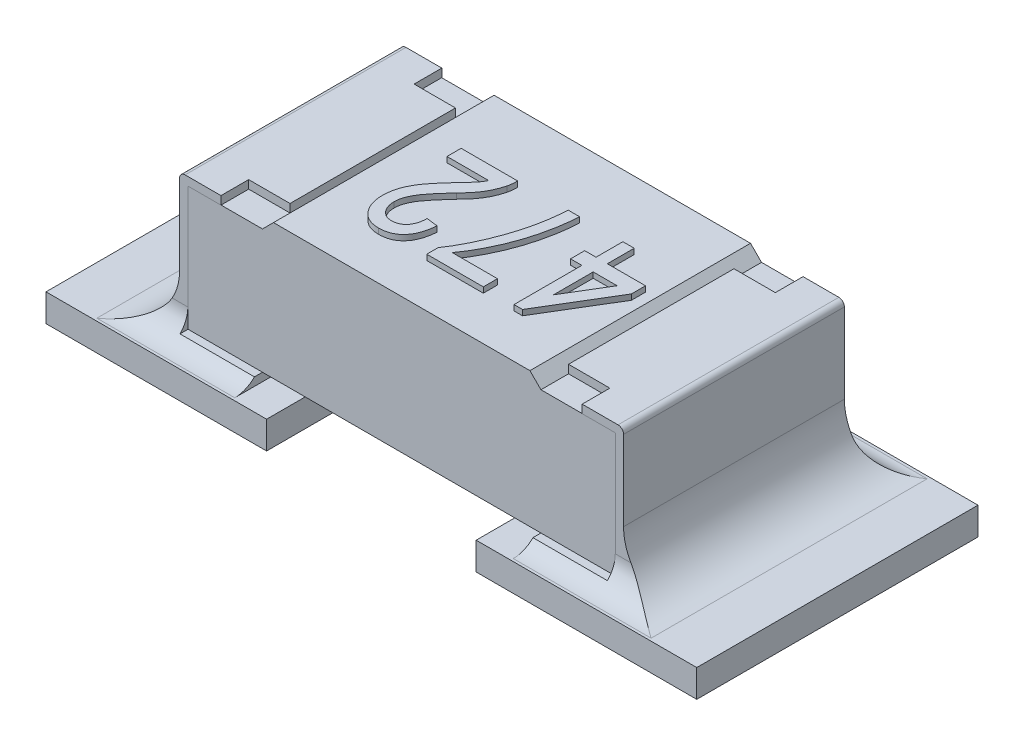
SolidWorks part; units mm, degrees
ref_plane "Plan de face" through (0, 0, 0) normal (0, 0, 1) x (1, 0, 0)
ref_plane "Plan de dessus" through (0, 0, 0) normal (0, 1, 0) x (1, 0, 0)
ref_plane "Plan de droite" through (0, 0, 0) normal (1, 0, 0) x (0, 0, -1)
sketch "Esquisse1" plane through (0, 0, 0) normal (1, 0, 0) x (0, 0, -1)
  line L1 (-0.4, 0.58) -> (0.4, 0.58)
  line L2 (-0.4, 0.58) -> (-0.4, 0.13)
  line L3 (-0.4, 0.13) -> (0.4, 0.13)
  line L4 (0.4, 0.58) -> (0.4, 0.13)
  dimension "D1" = 0.13
  dimension "D2" = 0.4
  dimension "D3" = 0.8
  dimension "D4" = 0.45
extrude "Extrusion1" add sketch "Esquisse1" along normal mid plane 1.55
sketch "Esquisse2" plane through (0, 0, 0) normal (0, 0, 1) x (1, 0, 0)
  line L4 (-0.505, 0.61) -> (-0.505, 0.58)
  line L5 (0.775, 0.58) -> (-0.775, 0.58) construction
  line L6 (-0.505, 0.13) -> (-0.505, 0.1)
  line L7 (0.775, 0.13) -> (-0.775, 0.13) construction
  line L8 (-0.805, 0.61) -> (-0.805, 0.1)
  line L9 (-0.805, 0.1) -> (0.805, 0.1)
  line L10 (0.805, 0.1) -> (0.805, 0.61)
  line L11 (0.805, 0.61) -> (-0.805, 0.61)
  line L12 (-0.805, 0.59) -> (-0.805, 0.1)
  line L13 (0.505, 0.61) -> (0.785, 0.61)
  line L14 (0.805, 0.1) -> (0.805, 0.59)
  line L15 (0.505, 0.1) -> (0.805, 0.1)
  line L16 (0.505, 0.61) -> (0.505, 0.58)
  line L17 (0.505, 0.13) -> (0.505, 0.1)
  line L18 (0.505, 0.13) -> (0.775, 0.13)
  line L19 (0.775, 0.13) -> (0.775, 0.58)
  line L20 (0.775, 0.58) -> (0.505, 0.58)
  line L21 (-0.505, 0.1) -> (-0.805, 0.1)
  line L22 (-0.505, 0.13) -> (-0.775, 0.13)
  line L23 (-0.775, 0.13) -> (-0.775, 0.58)
  line L24 (-0.775, 0.58) -> (-0.505, 0.58)
  line L26 (-0.785, 0.61) -> (-0.505, 0.61)
  arc A0 (0.805, 0.59) -> (0.785, 0.61) centre (0.785, 0.59) ccw
  arc A1 (-0.785, 0.61) -> (-0.805, 0.59) centre (-0.785, 0.59) ccw
  dimension "D4" = 0.02
  dimension "D2" = 0.3
  dimension "D3" = 0.3
  dimension "D1" = 0.03
extrude "Extrusion2" add sketch "Esquisse2" along normal mid plane 0.801
sketch "Esquisse3" plane through (0, 0.61, 0) normal (0, 1, 0) x (-1, 0, 0)
  line L0 (0.505, 0.4005) -> (0.505, -0.4005) construction
  line L1 (0.505, -0.5) -> (0.655, -0.5)
  line L2 (0.505, -0.5) -> (0.505, -0.3)
  line L3 (0.505, -0.3) -> (0.655, -0.3)
  line L4 (0.655, -0.5) -> (0.655, -0.3)
  line L5 (0, 0) -> (0, 0.6053) construction
  line L6 (-0.655, -0.5) -> (-0.655, -0.3)
  line L7 (-0.505, -0.3) -> (-0.655, -0.3)
  line L8 (-0.505, -0.5) -> (-0.505, -0.3)
  line L9 (-0.505, -0.5) -> (-0.655, -0.5)
  line L10 (0, 0) -> (0.2891, 0) construction
  line L11 (-0.505, 0.5) -> (-0.655, 0.5)
  line L12 (-0.505, 0.5) -> (-0.505, 0.3)
  line L13 (-0.505, 0.3) -> (-0.655, 0.3)
  line L14 (-0.655, 0.5) -> (-0.655, 0.3)
  line L15 (0.655, 0.5) -> (0.655, 0.3)
  line L16 (0.505, 0.3) -> (0.655, 0.3)
  line L17 (0.505, 0.5) -> (0.505, 0.3)
  line L18 (0.505, 0.5) -> (0.655, 0.5)
  dimension "D1" = 0.15
  dimension "D2" = 0.2
  dimension "D3" = 0.3
extrude "Enlèv. mat.-Extru.4" cut sketch "Esquisse3" against normal blind 0.03
sketch "Esquisse4" plane through (0, 0, 0) normal (0, 0, 1) x (1, 0, 0)
  line L0 (-0.505, 0.58) -> (-0.465, 0.62)
  line L1 (-0.465, 0.62) -> (0.465, 0.62)
  line L2 (0.465, 0.62) -> (0.505, 0.58)
  line L4 (0.505, 0.58) -> (-0.505, 0.58)
  line L8 (0.505, 0.61) -> (0.655, 0.61) construction
  point P3 (0.58, 0.61)
  dimension "D1" = 45
  dimension "D2" = 45
  dimension "D3" = 0.01
extrude "Extrusion5" add sketch "Esquisse4" along normal mid plane 0.8
sketch "Esquisse5" plane through (0, 0, 0) normal (0, 1, 0) x (1, 0, 0)
  line L0 (0, 0) -> (0, -0.6254) construction
  line L1 (-1.18, 0.51) -> (-0.38, 0.51)
  line L2 (-1.18, 0.51) -> (-1.18, -0.51)
  line L3 (-1.18, -0.51) -> (-0.38, -0.51)
  line L4 (-0.38, 0.51) -> (-0.38, -0.51)
  line L5 (0.38, 0.51) -> (0.38, -0.51)
  line L6 (1.18, -0.51) -> (0.38, -0.51)
  line L7 (1.18, 0.51) -> (1.18, -0.51)
  line L8 (1.18, 0.51) -> (0.38, 0.51)
  dimension "D1" = 0.38
  dimension "D2" = 1.02
  dimension "D3" = 0.51
  dimension "D4" = 0.8
extrude "Extrusion4" add sketch "Esquisse5" along normal blind 0.1
fillet "Congé1" radius 0.2 2 edges at (-0.805, 0.1, 0) (0.805, 0.1, 0)
fillet "Congé2" radius 0.1 12 edges at (-0.64, 0.13, -0.4005) (-0.755, 0.1, -0.4005) (-0.505, 0.115, -0.4005) (-0.755, 0.1, 0.4005) (-0.505, 0.115, 0.4005) (-0.64, 0.13, 0.4005) (0.64, 0.13, -0.4005) (0.755, 0.1, -0.4005) (0.505, 0.115, -0.4005) (0.755, 0.1, 0.4005) (0.64, 0.13, 0.4005) (0.505, 0.115, 0.4005)
sketch "Esquisse6" plane through (0, 0.62, 0) normal (0, 1, 0) x (-1, 0, 0)
  line L1 (-0.4332, -0.1535) -> (0.3855, -0.1535) construction
  text T0 "472" font "Arial" height 0.4
extrude "Extrusion6" add sketch "Esquisse6" along normal blind 0.02
